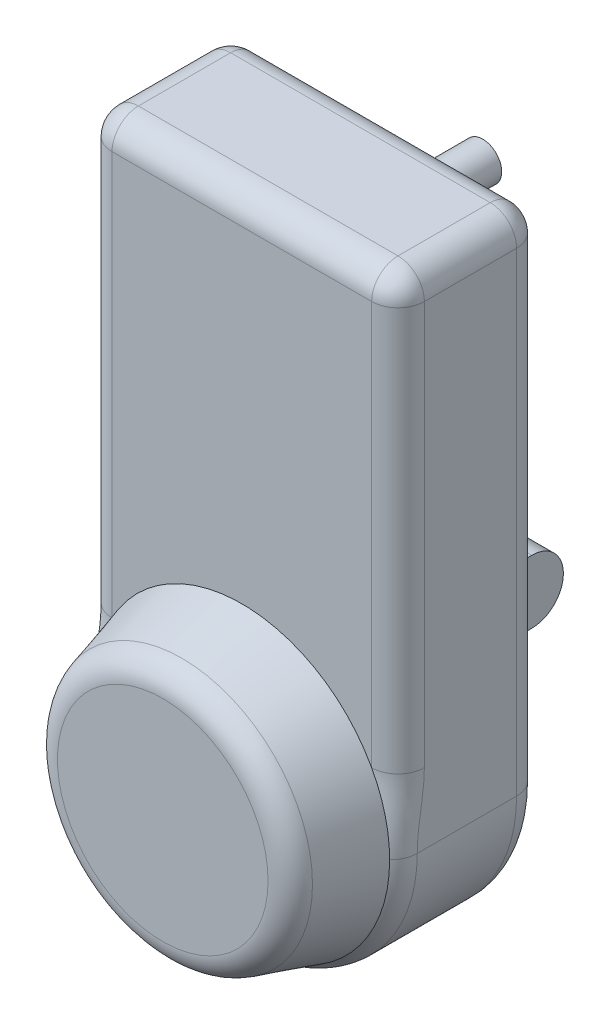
SolidWorks part; units mm, degrees
ref_plane "Front" through (0, 0, 0) normal (0, 0, 1) x (1, 0, 0)
ref_plane "Top" through (0, 0, 0) normal (0, 1, 0) x (1, 0, 0)
ref_plane "Right" through (0, 0, 0) normal (1, 0, 0) x (0, 0, -1)
sketch "Sketch1" plane through (0, 0, 0) normal (0, 0, 1) x (1, 0, 0)
  line L0 (0, 0) -> (0, 48.26) construction
  line L2 (-15.0495, 0) -> (-15.0495, 48.26)
  line L3 (-15.0495, 48.26) -> (15.0495, 48.26)
  line L4 (15.0495, 0) -> (15.0495, 48.26)
  arc A0 (-15.0495, 0) -> (15.0495, 0) centre (0, 0) ccw
  dimension "D1" = 30.099
  dimension "D2" = 48.26
extrude "Extrude1" add sketch "Sketch1" along normal blind 13.97
sketch "Sketch2" plane through (0, 0, 13.97) normal (0, 0, 1) x (1, 0, 0)
  circle A0 centre (0, 0) radius 14.2453
extrude "Extrude2" add sketch "Sketch2" along normal blind 7.62 draft 16
fillet "Fillet1" radius 2.54 1 edges at (12.0603, 0, 21.59)
fillet "Fillet4" radius 2.54 10 edges at (15.0495, 24.13, 13.97) (0, -15.0495, 13.97) (-15.0495, 24.13, 13.97) (15.0495, 48.26, 6.985) (0, 48.26, 13.97) (-15.0495, 48.26, 6.985) (15.0495, 24.13, 0) (0, 48.26, 0) (-15.0495, 24.13, 0) (0, -15.0495, 0)
sketch "Sketch3" plane through (0, 0, 0) normal (0, 0, -1) x (-1, 0, 0)
  circle A0 centre (-1.6297, 41.2167) radius 1.8237
extrude "Extrude3" add sketch "Sketch3" along normal blind 7.62
sketch "Sketch4" plane through (0, 0, 0) normal (1, 0, 0) x (0, 0, -1)
  line L0 (0, 8.382) -> (0, 14.478)
  line L1 (0, 45.72) -> (0, 0) construction
  line L2 (0, 14.478) -> (3.81, 14.478)
  line L3 (3.81, 8.382) -> (0, 8.382)
  arc A0 (3.81, 14.478) -> (3.81, 8.382) centre (3.81, 11.43) cw
  dimension "D1" = 11.43
  dimension "D2" = 6.096
  dimension "D3" = 3.81
extrude "Extrude4" add sketch "Sketch4" along normal blind 10.16
